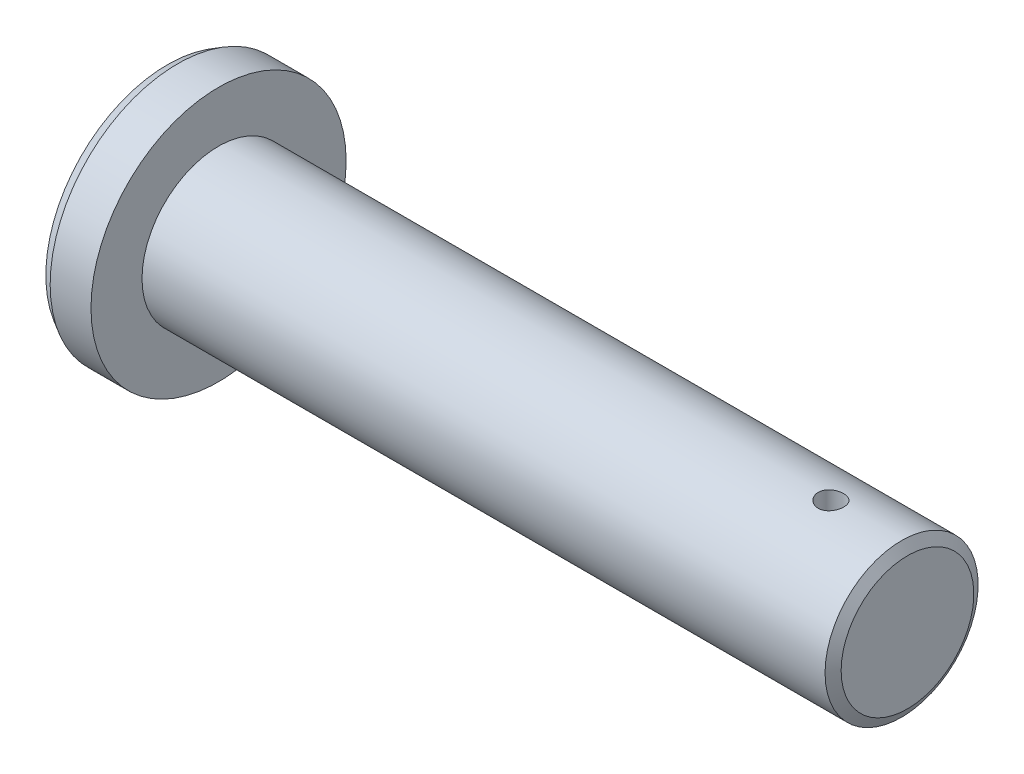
SolidWorks part; units mm, degrees
ref_plane "Plan de face" through (0, 0, 0) normal (0, 0, 1) x (1, 0, 0)
ref_plane "Plan de dessus" through (0, 0, 0) normal (0, 1, 0) x (1, 0, 0)
ref_plane "Plan de droite" through (0, 0, 0) normal (1, 0, 0) x (0, 0, -1)
sketch "Esquisse1" plane through (0, 0, 0) normal (0, 0, 1) x (1, 0, 0)
  line L0 (-77.0454, 0) -> (97.5764, 0) construction
  line L1 (0, 0) -> (0, 25)
  line L2 (0, 25) -> (10, 25)
  line L3 (10, 25) -> (10, 15)
  line L4 (10, 15) -> (145, 15)
  line L5 (145, 15) -> (145, 0)
  line L6 (0, 0) -> (145, 0)
  dimension "D1" = 25
  dimension "D2" = 15
  dimension "D3" = 10
  dimension "D4" = 145
revolve "Révolution1" add sketch "Esquisse1" angle 360 about L0
chamfer "Chanfrein1" distance 2 angle 30 2 edges at (0, 0, 25) (145, 0, 15)
sketch "Esquisse2" plane through (0, 0, 0) normal (0, 1, 0) x (1, 0, 0)
  line L0 (-77.0454, 0) -> (97.5764, 0) construction
  line L1 (10, -25) -> (10, 25) construction
  circle A0 centre (130, 0) radius 2.5
  dimension "D1" = 5
  dimension "D2" = 120
extrude "Enlèv. mat.-Extru.1" cut sketch "Esquisse2" against normal through all and the other way through all
